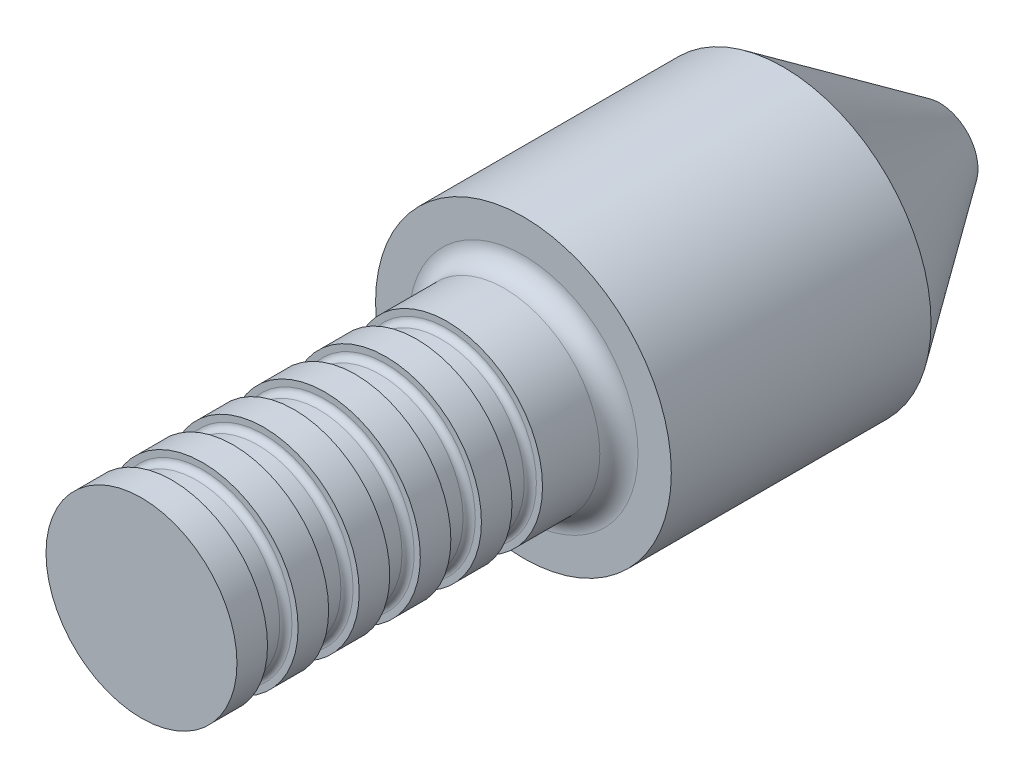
SolidWorks part; units mm, degrees
ref_plane "Front" through (0, 0, 0) normal (0, 0, 1) x (1, 0, 0)
ref_plane "Top" through (0, 0, 0) normal (0, 1, 0) x (1, 0, 0)
ref_plane "Right" through (0, 0, 0) normal (1, 0, 0) x (0, 0, -1)
sketch "Sketch2" plane through (0, 0, 0) normal (1, 0, 0) x (0, 0, -1)
  line L0 (0, 0) -> (0, 3.9688)
  line L1 (0, 3.9688) -> (1.27, 3.9688)
  line L2 (15.875, 4.7625) -> (15.875, 6.1468)
  line L3 (15.875, 6.1468) -> (26.67, 6.1468)
  line L5 (26.67, 6.1468) -> (33.1814, 1.5875)
  line L7 (0, 0) -> (30.64, 0)
  line L8 (33.1814, 1.5875) -> (31.5939, 1.5875)
  line L9 (31.5939, 1.5875) -> (30.64, 0)
  line L10 (1.27, 3.9688) -> (1.27, 3.7147)
  line L11 (1.524, 3.4608) -> (2.286, 3.4608)
  line L12 (2.54, 3.7147) -> (2.54, 3.9688)
  line L13 (5.08, 3.7147) -> (5.08, 3.9688)
  line L14 (4.064, 3.4608) -> (4.826, 3.4608)
  line L15 (3.81, 3.9688) -> (3.81, 3.7147)
  line L16 (7.62, 3.7147) -> (7.62, 3.9688)
  line L17 (6.604, 3.4608) -> (7.366, 3.4608)
  line L18 (6.35, 3.9688) -> (6.35, 3.7147)
  line L19 (10.16, 3.7147) -> (10.16, 3.9688)
  line L20 (9.144, 3.4608) -> (9.906, 3.4608)
  line L21 (8.89, 3.9688) -> (8.89, 3.7147)
  line L22 (12.7, 3.7147) -> (12.7, 3.9688)
  line L23 (11.684, 3.4608) -> (12.446, 3.4608)
  line L24 (11.43, 3.9688) -> (11.43, 3.7147)
  line L25 (2.54, 3.9688) -> (3.81, 3.9688)
  line L26 (5.08, 3.9688) -> (6.35, 3.9688)
  line L27 (7.62, 3.9688) -> (8.89, 3.9688)
  line L28 (10.16, 3.9688) -> (11.43, 3.9688)
  line L29 (12.7, 3.9688) -> (15.0813, 3.9687)
  arc A0 (11.684, 3.4608) -> (11.43, 3.7147) centre (11.684, 3.7147) cw
  arc A1 (12.7, 3.7147) -> (12.446, 3.4608) centre (12.446, 3.7147) cw
  arc A2 (9.144, 3.4608) -> (8.89, 3.7147) centre (9.144, 3.7147) cw
  arc A3 (10.16, 3.7147) -> (9.906, 3.4608) centre (9.906, 3.7147) cw
  arc A4 (6.604, 3.4608) -> (6.35, 3.7147) centre (6.604, 3.7147) cw
  arc A5 (7.62, 3.7147) -> (7.366, 3.4608) centre (7.366, 3.7147) cw
  arc A6 (4.064, 3.4608) -> (3.81, 3.7147) centre (4.064, 3.7147) cw
  arc A7 (5.08, 3.7147) -> (4.826, 3.4608) centre (4.826, 3.7147) cw
  arc A8 (1.27, 3.7147) -> (1.524, 3.4608) centre (1.524, 3.7147) ccw
  arc A9 (2.286, 3.4608) -> (2.54, 3.7147) centre (2.286, 3.7147) ccw
  arc A10 (15.0813, 3.9687) -> (15.875, 4.7625) centre (15.0813, 4.7625) ccw
  point P55 (15.875, 3.9688)
  dimension "D5" = 1.27
  dimension "D13" = 0.254
  dimension "D18" = 0.7937
  dimension "D1" = 3.9688
  dimension "D2" = 15.875
  dimension "D3" = 10.795
  dimension "D4" = 35
  dimension "D6" = 6.1468
  dimension "D7" = 1.5875
  dimension "D8" = 59
  dimension "D9" = 1.5875
  dimension "D10" = 1.27
  dimension "D11" = 0.508
  dimension "D12" = 5
revolve "Revolve1" add sketch "Sketch2" angle 360 about L7
